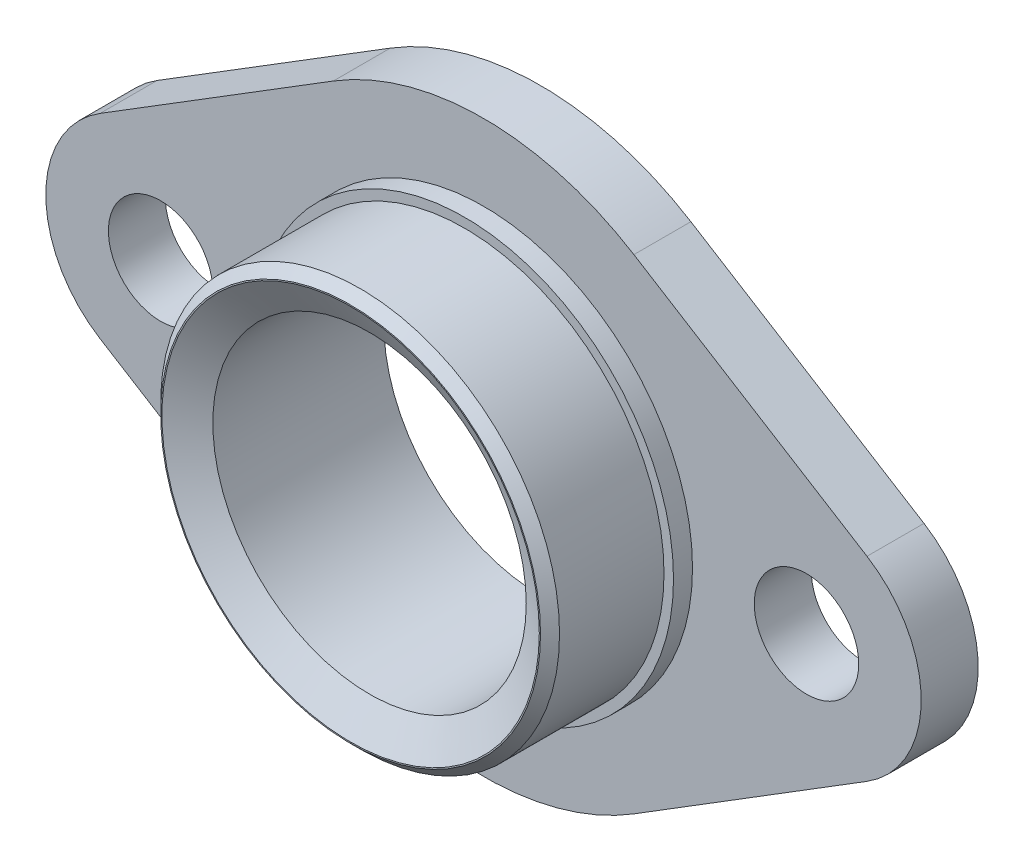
SolidWorks part; units mm, degrees
ref_plane "前视" through (0, 0, 0) normal (0, 0, 1) x (1, 0, 0)
ref_plane "上视" through (0, 0, 0) normal (0, 1, 0) x (1, 0, 0)
ref_plane "右视" through (0, 0, 0) normal (1, 0, 0) x (0, 0, -1)
sketch "草图1" plane through (0, 0, 0) normal (0, 0, 1) x (1, 0, 0)
  line L0 (-15.8176, 25.5041) -> (-40.3726, 10.2752)
  line L1 (15.8281, 25.4976) -> (40.3706, 10.2625)
  line L2 (-50.8019, 0) -> (48.63, 0) construction
  line L3 (15.8281, -25.4976) -> (40.3706, -10.2625)
  line L4 (-15.8176, -25.5041) -> (-40.3726, -10.2752)
  arc A0 (15.8281, -25.4976) -> (-15.8176, -25.5041) centre (0, 0) cw
  circle A1 centre (-34, 0) radius 5.5
  circle A2 centre (34, 0) radius 5.5
  arc A3 (-40.3726, 10.2752) -> (-40.3726, -10.2752) centre (-34, 0) ccw
  arc A4 (40.3706, -10.2625) -> (40.3706, 10.2625) centre (34, 0) ccw
  arc A5 (15.8281, 25.4976) -> (-15.8176, 25.5041) centre (0, 0) ccw
  circle A6 centre (0, 0) radius 16.5
extrude "拉伸1" add sketch "草图1" along normal blind 6
sketch "草图2" plane through (0, 0, 6) normal (0, 0, 1) x (1, 0, 0)
  circle A0 centre (0, 0) radius 22
  arc A1 (15.8281, 25.4976) -> (-15.8176, 25.5041) centre (0, 0) ccw construction
  dimension "D1" = 44
extrude "拉伸2" add sketch "草图2" along normal blind 2
sketch "草图3" plane through (0, 0, 8) normal (0, 0, 1) x (1, 0, 0)
  circle A0 centre (0, 0) radius 21
  circle A1 centre (0, 0) radius 22 construction
  dimension "D1" = 42
extrude "拉伸3" add sketch "草图3" along normal blind 12
sketch "草图4" plane through (0, 0, 6) normal (0, 0, -1) x (-1, 0, 0)
  circle A0 centre (0, 0) radius 16.5
  circle A1 centre (0, 0) radius 16.5 construction
extrude "切除-拉伸1" cut sketch "草图4" against normal through all
chamfer "倒角2" distance 1 angle 45
sketch "草图6" plane through (0, 0, 0) normal (1, 0, 0) x (0, 0, -1)
  line L0 (-20.6706, 21) -> (-20.6706, 0)
  line L1 (-6, 0) -> (0, 0) construction
  line L2 (-20.6706, 0) -> (-18.0048, 0)
  line L4 (-30.2061, 0) -> (8.0824, 0) construction
  line L8 (-18.0048, 0) -> (-18.0048, 16.5)
  line L9 (-20.6706, 21) -> (-18.0048, 16.5)
  dimension "D1" = 21
  dimension "D3" = 16.5
revolve "切除-旋转8" cut sketch "草图6" angle 360 about L4
